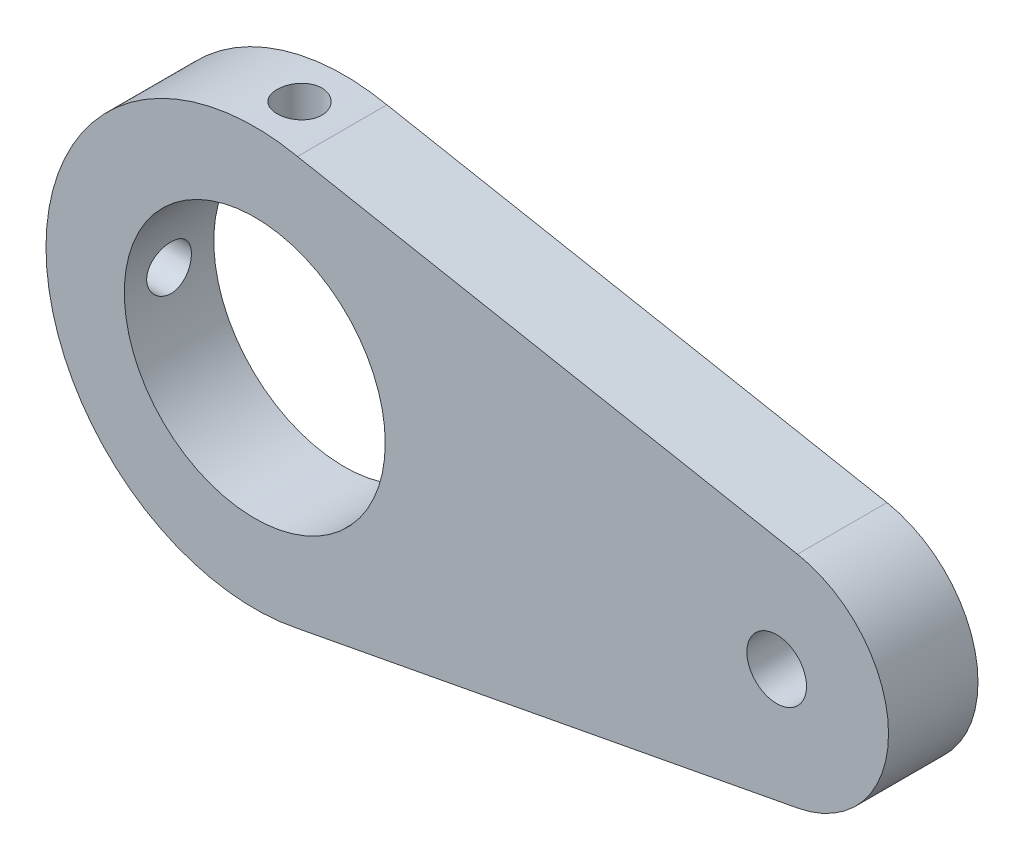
SolidWorks part; units mm, degrees
ref_plane "前视基准面" through (0, 0, 0) normal (0, 0, 1) x (1, 0, 0)
ref_plane "上视基准面" through (0, 0, 0) normal (0, 1, 0) x (1, 0, 0)
ref_plane "右视基准面" through (0, 0, 0) normal (1, 0, 0) x (0, 0, -1)
sketch "草图1" plane through (0, 0, 0) normal (0, 0, 1) x (1, 0, 0)
  line L0 (0, 0) -> (70, 0) construction
  line L1 (5.7256, 27.4083) -> (72.7846, 14.7393)
  line L2 (5.7256, -27.4083) -> (72.7846, -14.7393)
  circle A0 centre (0, 0) radius 17.5
  arc A1 (5.7256, 27.4083) -> (5.7256, -27.4083) centre (0, 0) ccw
  circle A2 centre (70, 0) radius 4
  arc A3 (72.7846, -14.7393) -> (72.7846, 14.7393) centre (70, 0) ccw
extrude "凸台-拉伸1" add sketch "草图1" along normal blind 12
ref_plane "基准面1" through (0, 28, 0) normal (0, 1, 0) x (1, 0, 0)
sketch "草图2" plane through (0, 28, 0) normal (0, 1, 0) x (1, 0, 0)
  line L0 (0, 0) -> (0, -12) construction
  circle A0 centre (0, -6) radius 3
extrude "切除-拉伸1" cut sketch "草图2" against normal blind 12
ref_plane "基准面2" through (-28, 0, 0) normal (1, 0, 0) x (0, 0, -1)
sketch "草图3" plane through (-28, 0, 0) normal (1, 0, 0) x (0, 0, -1)
  line L0 (0, 0) -> (-12, 0) construction
  circle A0 centre (-6, 0) radius 3
extrude "切除-拉伸3" cut sketch "草图3" along normal blind 19
